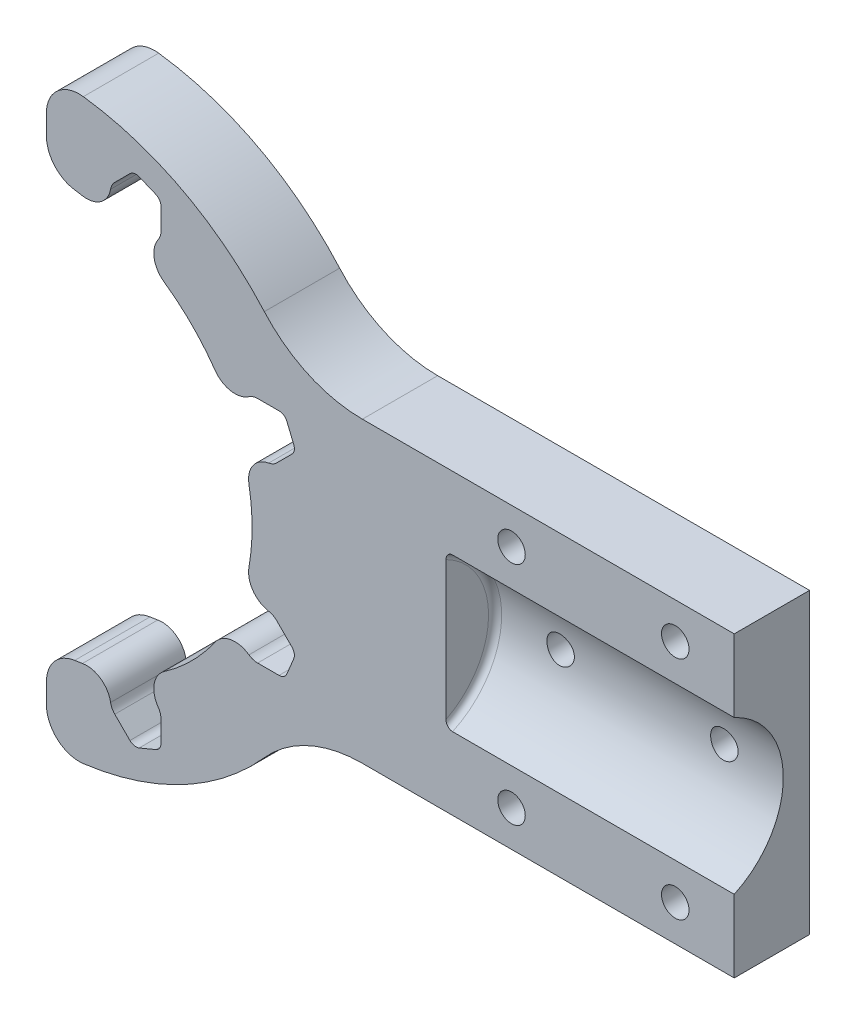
SolidWorks part; units mm, degrees
ref_plane "Front Plane" through (0, 0, 0) normal (1, 0, 0) x (0, 1, 0)
ref_plane "Top Plane" through (0, 0, 0) normal (0, 0, 1) x (0, 1, 0)
ref_plane "Right Plane" through (0, 0, 0) normal (0, 1, 0) x (-1, 0, 0)
sketch "Sketch1" plane through (0, 0, 0) normal (1, 0, 0) x (0, 1, 0)
  line L0 (-11.6833, 0) -> (-22.75, 0)
  line L1 (-22.75, 0) -> (-22.75, -11.5)
  line L2 (-22.75, -11.5) -> (22.75, -11.5)
  line L3 (11.6833, 0) -> (22.75, 0)
  line L4 (22.75, 0) -> (22.75, -11.5)
  arc A0 (-11.6833, 0) -> (11.6833, 0) centre (0, 5.35) ccw
  circle A3 centre (0, 5.35) radius 12.85 construction
  point P7 (0, -11.5)
  dimension "D1" = 12.85
  dimension "D3" = 4
  dimension "D2" = 45.5
  dimension "D4" = 5.35
  dimension "D5" = 11.5
extrude "Boss-Extrude1" add sketch "Sketch1" along normal blind 50
sketch "Sketch3" plane through (0, 0, 0) normal (0, 0, 1) x (1, 0, 0)
  line L0 (0, 22.75) -> (-16.8131, 22.75)
  line L1 (0, 0) -> (-55, 0) construction
  line L2 (0, 11.6833) -> (0, -11.6833) construction
  line L3 (-55, 44.45) -> (-55, -44.45)
  line L4 (0, 22.75) -> (0, -22.75)
  line L5 (0, -22.75) -> (-16.8131, -22.75)
  arc A0 (-55, 44.45) -> (-16.8131, 22.75) centre (-55, 0) cw
  arc A1 (-16.8131, -22.75) -> (-55, -44.45) centre (-55, 0) cw
  point P9 (-55, 0)
  dimension "D2" = 44.45
  dimension "D1" = 55
extrude "Boss-Extrude2" add sketch "Sketch3" against normal blind 11.5
sketch "Sketch4" plane through (0, 0, 0) normal (1, 0, 0) x (0, 1, 0)
  line L2 (11.6833, 0) -> (-11.6833, 0)
  line L3 (11.6833, 0) -> (-11.6833, 0)
  arc A3 (-11.6833, 0) -> (11.6833, 0) centre (0, 5.35) ccw
  arc A4 (-11.6833, 0) -> (11.6833, 0) centre (0, 5.35) ccw
  dimension "D1" = 0
extrude "Boss-Extrude3" add sketch "Sketch4" along normal blind 6
sketch "Sketch5" plane through (0, 0, -11.5) normal (0, 0, -1) x (1, 0, 0)
  line L0 (-55, 0) -> (-17.5829, 15.4987) construction
  line L1 (-55, -44.45) -> (-55, 44.45) construction
  line L2 (-55, 0) -> (0, 0) construction
  line L3 (-18.1049, 16.759) -> (-17.0608, 14.2383)
  line L4 (-19.4907, 17.685) -> (-22.7607, 17.685)
  line L5 (-17.386, 12.6037) -> (-19.6982, 10.2914)
  line L6 (-55, 31.6) -> (-55, -31.6)
  line L7 (-55, 0) -> (-32.6554, 22.3446) construction
  line L8 (-42.3963, 37.614) -> (-44.7086, 35.3018)
  line L9 (-38.241, 36.8951) -> (-40.7617, 37.9392)
  line L10 (-37.315, 35.5093) -> (-37.315, 32.2393)
  line L11 (-17.386, -12.6037) -> (-19.6982, -10.2914)
  line L12 (-18.1049, -16.759) -> (-17.0608, -14.2383)
  line L13 (-19.4907, -17.685) -> (-22.7607, -17.685)
  line L14 (-37.315, -35.5093) -> (-37.315, -32.2393)
  line L15 (-38.241, -36.8951) -> (-40.7617, -37.9392)
  line L16 (-42.3963, -37.614) -> (-44.7086, -35.3018)
  arc A0 (-55, 31.6) -> (-49.4658, 31.1116) centre (-55, 0) cw
  arc A1 (-18.1049, 16.759) -> (-19.4907, 17.685) centre (-19.4907, 16.185) ccw
  arc A2 (-22.7607, 17.685) -> (-24.201, 17.2284) centre (-22.7607, 15.185) ccw
  arc A3 (-29.0875, 18.086) -> (-24.201, 17.2284) centre (-26.2175, 20.0892) ccw
  arc A4 (-17.0608, 14.2383) -> (-17.386, 12.6037) centre (-18.4466, 13.6643) cw
  arc A5 (-19.6982, 10.2914) -> (-21.0395, 9.5958) centre (-21.466, 12.0592) cw
  arc A6 (-23.8884, 5.5342) -> (-21.0395, 9.5958) centre (-20.4425, 6.1471) cw
  arc A7 (-23.8884, 5.5342) -> (-23.8884, -5.5342) centre (-55, 0) cw
  arc A9 (-49.4658, 31.1116) -> (-45.4042, 33.9605) centre (-48.8529, 34.5575) ccw
  arc A10 (-44.7086, 35.3018) -> (-45.4042, 33.9605) centre (-42.9408, 33.534) ccw
  arc A11 (-40.7617, 37.9392) -> (-42.3963, 37.614) centre (-41.3357, 36.5534) ccw
  arc A12 (-38.241, 36.8951) -> (-37.315, 35.5093) centre (-38.815, 35.5093) cw
  arc A13 (-37.315, 32.2393) -> (-37.7716, 30.799) centre (-39.815, 32.2393) cw
  arc A14 (-36.914, 25.9125) -> (-37.7716, 30.799) centre (-34.9108, 28.7825) cw
  arc A15 (-36.914, 25.9125) -> (-29.0875, 18.086) centre (-55, 0) cw
  arc A16 (-23.8884, -5.5342) -> (-21.0395, -9.5958) centre (-20.4425, -6.1471) ccw
  arc A17 (-19.6982, -10.2914) -> (-21.0395, -9.5958) centre (-21.466, -12.0592) ccw
  arc A18 (-17.0608, -14.2383) -> (-17.386, -12.6037) centre (-18.4466, -13.6643) ccw
  arc A19 (-18.1049, -16.759) -> (-19.4907, -17.685) centre (-19.4907, -16.185) cw
  arc A20 (-22.7607, -17.685) -> (-24.201, -17.2284) centre (-22.7607, -15.185) cw
  arc A21 (-29.0875, -18.086) -> (-24.201, -17.2284) centre (-26.2175, -20.0892) cw
  arc A22 (-36.914, -25.9125) -> (-37.7716, -30.799) centre (-34.9108, -28.7825) ccw
  arc A23 (-37.315, -32.2393) -> (-37.7716, -30.799) centre (-39.815, -32.2393) ccw
  arc A24 (-38.241, -36.8951) -> (-37.315, -35.5093) centre (-38.815, -35.5093) ccw
  arc A25 (-40.7617, -37.9392) -> (-42.3963, -37.614) centre (-41.3357, -36.5534) cw
  arc A26 (-44.7086, -35.3018) -> (-45.4042, -33.9605) centre (-42.9408, -33.534) cw
  arc A27 (-49.4658, -31.1116) -> (-45.4042, -33.9605) centre (-48.8529, -34.5575) cw
  arc A28 (-29.0875, -18.086) -> (-36.914, -25.9125) centre (-55, 0) cw
  arc A29 (-49.4658, -31.1116) -> (-55, -31.6) centre (-55, 0) cw
  point P9 (-17.5829, 15.4987)
  dimension "D3" = 31.6
  dimension "D4" = 1.5
  dimension "D6" = 2.5
  dimension "D7" = 3.5
  dimension "D1" = 40.5
  dimension "D2" = 22.5
  dimension "D5" = 3.27
  dimension "D8" = 5.5
  dimension "D9" = 45
extrude "Cut-Extrude1" cut sketch "Sketch5" against normal through all
fillet "Fillet6" radius 20 2 edges at (-16.8131, -22.75, -5.75) (-16.8131, 22.75, -5.75)
fillet "Fillet7" radius 1 1 edges at (6, 0, -7.5)
sketch "Sketch6" plane through (0, 0, 0) normal (0, 0, 1) x (1, 0, 0)
  line L0 (50, 11.6833) -> (7, 11.6833) construction
  line L1 (41, 17.25) -> (16, 17.25) construction
  line L2 (50, 22.75) -> (50, 11.6833) construction
  line L4 (41, 17.25) -> (41, -17.25) construction
  circle A0 centre (41, 17.25) radius 2.1
  circle A1 centre (16, 17.25) radius 2.1
  circle A2 centre (16, -17.25) radius 2.1
  circle A3 centre (41, -17.25) radius 2.1
  point P10 (28.5, 11.6833)
  point P11 (28.5, 17.25)
  point P15 (41, 0)
  dimension "D2" = 4.2
  dimension "D4" = 34.5
  dimension "D1" = 25
  dimension "D3" = 9
extrude "Cut-Extrude2" cut sketch "Sketch6" against normal through all
sketch "Sketch8" plane through (0, 0, 0) normal (0, 0, 1) x (1, 0, 0)
  line L126 (-22.7607, -17.485) -> (-19.4907, -17.485)
  line L127 (-18.2897, -16.6825) -> (-17.2456, -14.1618)
  line L128 (-17.5274, -12.7451) -> (-19.8396, -10.4328)
  line L129 (-19.8396, 10.4328) -> (-17.5274, 12.7451)
  line L130 (-17.2456, 14.1618) -> (-18.2897, 16.6825)
  line L131 (-19.4907, 17.485) -> (-22.7607, 17.485)
  line L132 (-37.515, 32.2393) -> (-37.515, 35.5093)
  line L133 (-38.3175, 36.7103) -> (-40.8382, 37.7544)
  line L134 (-42.2549, 37.4726) -> (-44.5672, 35.1604)
  line L135 (-22.7607, -17.485) -> (-19.4907, -17.485)
  line L136 (-18.2897, -16.6825) -> (-17.2456, -14.1618)
  line L137 (-17.5274, -12.7451) -> (-19.8396, -10.4328)
  line L138 (-19.8396, 10.4328) -> (-17.5274, 12.7451)
  line L139 (-17.2456, 14.1618) -> (-18.2897, 16.6825)
  line L140 (-19.4907, 17.485) -> (-22.7607, 17.485)
  line L141 (-37.515, 32.2393) -> (-37.515, 35.5093)
  line L142 (-38.3175, 36.7103) -> (-40.8382, 37.7544)
  line L143 (-42.2549, 37.4726) -> (-44.5672, 35.1604)
  line L156 (-44.5672, -35.1604) -> (-42.2549, -37.4726)
  line L157 (-40.8382, -37.7544) -> (-38.3175, -36.7103)
  line L158 (-37.515, -35.5093) -> (-37.515, -32.2393)
  line L159 (-44.5672, -35.1604) -> (-42.2549, -37.4726)
  line L160 (-40.8382, -37.7544) -> (-38.3175, -36.7103)
  line L161 (-37.515, -35.5093) -> (-37.515, -32.2393)
  line L201 (-55, -31.4) -> (-55, -31.6)
  line L202 (-55, 31.6) -> (-55, 31.4)
  line L203 (-55, -31.6) -> (-55, -44.45) construction
  line L204 (-55, 44.45) -> (-55, 31.6) construction
  line L222 (-55, -31.6) -> (-55, -44.45)
  line L223 (-6.7689, -22.75) -> (50, -22.75)
  line L224 (50, -22.75) -> (50, -11.6833)
  line L225 (50, -11.6833) -> (7, -11.6833)
  line L226 (6, -10.5736) -> (6, 10.5736)
  line L227 (7, 11.6833) -> (50, 11.6833)
  line L228 (50, 11.6833) -> (50, 22.75)
  line L229 (50, 22.75) -> (-6.7689, 22.75)
  line L230 (-55, 44.45) -> (-55, 31.6)
  line L231 (-44.7086, 35.3018) -> (-42.3963, 37.614)
  line L232 (-40.7617, 37.9392) -> (-38.241, 36.8951)
  line L233 (-37.315, 35.5093) -> (-37.315, 32.2393)
  line L234 (-22.7607, 17.685) -> (-19.4907, 17.685)
  line L235 (-18.1049, 16.759) -> (-17.0608, 14.2383)
  line L236 (-17.386, 12.6037) -> (-19.6982, 10.2914)
  line L237 (-19.6982, -10.2914) -> (-17.386, -12.6037)
  line L238 (-17.0608, -14.2383) -> (-18.1049, -16.759)
  line L239 (-19.4907, -17.685) -> (-22.7607, -17.685)
  line L240 (-37.315, -32.2393) -> (-37.315, -35.5093)
  line L241 (-38.241, -36.8951) -> (-40.7617, -37.9392)
  line L242 (-42.3963, -37.614) -> (-44.7086, -35.3018)
  line L245 (50, -22.75) -> (50, -11.6833)
  line L246 (50, -11.6833) -> (7, -11.6833)
  line L247 (6, -10.5736) -> (6, 10.5736)
  line L248 (7, 11.6833) -> (50, 11.6833)
  line L249 (50, 11.6833) -> (50, 22.75)
  line L252 (-44.7086, 35.3018) -> (-42.3963, 37.614)
  line L253 (-40.7617, 37.9392) -> (-38.241, 36.8951)
  line L254 (-37.315, 35.5093) -> (-37.315, 32.2393)
  line L255 (-22.7607, 17.685) -> (-19.4907, 17.685)
  line L256 (-18.1049, 16.759) -> (-17.0608, 14.2383)
  line L257 (-17.386, 12.6037) -> (-19.6982, 10.2914)
  line L258 (-19.6982, -10.2914) -> (-17.386, -12.6037)
  line L259 (-17.0608, -14.2383) -> (-18.1049, -16.759)
  line L260 (-19.4907, -17.685) -> (-22.7607, -17.685)
  line L261 (-37.315, -32.2393) -> (-37.315, -35.5093)
  line L262 (-38.241, -36.8951) -> (-40.7617, -37.9392)
  line L263 (-42.3963, -37.614) -> (-44.7086, -35.3018)
  arc A308 (-19.4907, -17.485) -> (-18.2897, -16.6825) centre (-19.4907, -16.185) ccw
  arc A309 (-17.2456, -14.1618) -> (-17.5274, -12.7451) centre (-18.4466, -13.6643) ccw
  arc A310 (-19.8396, -10.4328) -> (-21.0736, -9.7929) centre (-21.466, -12.0592) ccw
  arc A311 (-24.0853, -5.4991) -> (-21.0736, -9.7929) centre (-20.4425, -6.1471) ccw
  arc A312 (-24.0853, -5.4991) -> (-24.0853, 5.4991) centre (-55, 0) ccw
  arc A313 (-21.0736, 9.7929) -> (-24.0853, 5.4991) centre (-20.4425, 6.1471) ccw
  arc A314 (-21.0736, 9.7929) -> (-19.8396, 10.4328) centre (-21.466, 12.0592) ccw
  arc A315 (-17.5274, 12.7451) -> (-17.2456, 14.1618) centre (-18.4466, 13.6643) ccw
  arc A316 (-18.2897, 16.6825) -> (-19.4907, 17.485) centre (-19.4907, 16.185) ccw
  arc A317 (-22.7607, 17.485) -> (-24.0858, 17.0649) centre (-22.7607, 15.185) ccw
  arc A318 (-29.2515, 17.9715) -> (-24.0858, 17.0649) centre (-26.2175, 20.0892) ccw
  arc A319 (-29.2515, 17.9715) -> (-37.0285, 25.7485) centre (-55, 0) ccw
  arc A320 (-37.9351, 30.9142) -> (-37.0285, 25.7485) centre (-34.9108, 28.7825) ccw
  arc A321 (-37.9351, 30.9142) -> (-37.515, 32.2393) centre (-39.815, 32.2393) ccw
  arc A322 (-37.515, 35.5093) -> (-38.3175, 36.7103) centre (-38.815, 35.5093) ccw
  arc A323 (-40.8382, 37.7544) -> (-42.2549, 37.4726) centre (-41.3357, 36.5534) ccw
  arc A324 (-44.5672, 35.1604) -> (-45.2071, 33.9264) centre (-42.9408, 33.534) ccw
  arc A325 (-49.5009, 30.9147) -> (-45.2071, 33.9264) centre (-48.8529, 34.5575) ccw
  arc A326 (-49.5009, 30.9147) -> (-55, 31.4) centre (-55, 0) ccw
  arc A327 (-19.4907, -17.485) -> (-18.2897, -16.6825) centre (-19.4907, -16.185) ccw
  arc A328 (-17.2456, -14.1618) -> (-17.5274, -12.7451) centre (-18.4466, -13.6643) ccw
  arc A329 (-19.8396, -10.4328) -> (-21.0736, -9.7929) centre (-21.466, -12.0592) ccw
  arc A330 (-24.0853, -5.4991) -> (-21.0736, -9.7929) centre (-20.4425, -6.1471) ccw
  arc A331 (-24.0853, -5.4991) -> (-24.0853, 5.4991) centre (-55, 0) ccw
  arc A332 (-21.0736, 9.7929) -> (-24.0853, 5.4991) centre (-20.4425, 6.1471) ccw
  arc A333 (-21.0736, 9.7929) -> (-19.8396, 10.4328) centre (-21.466, 12.0592) ccw
  arc A334 (-17.5274, 12.7451) -> (-17.2456, 14.1618) centre (-18.4466, 13.6643) ccw
  arc A335 (-18.2897, 16.6825) -> (-19.4907, 17.485) centre (-19.4907, 16.185) ccw
  arc A336 (-22.7607, 17.485) -> (-24.0858, 17.0649) centre (-22.7607, 15.185) ccw
  arc A337 (-29.2515, 17.9715) -> (-24.0858, 17.0649) centre (-26.2175, 20.0892) ccw
  arc A338 (-29.2515, 17.9715) -> (-37.0285, 25.7485) centre (-55, 0) ccw
  arc A339 (-37.9351, 30.9142) -> (-37.0285, 25.7485) centre (-34.9108, 28.7825) ccw
  arc A340 (-37.9351, 30.9142) -> (-37.515, 32.2393) centre (-39.815, 32.2393) ccw
  arc A341 (-37.515, 35.5093) -> (-38.3175, 36.7103) centre (-38.815, 35.5093) ccw
  arc A342 (-40.8382, 37.7544) -> (-42.2549, 37.4726) centre (-41.3357, 36.5534) ccw
  arc A343 (-44.5672, 35.1604) -> (-45.2071, 33.9264) centre (-42.9408, 33.534) ccw
  arc A344 (-49.5009, 30.9147) -> (-45.2071, 33.9264) centre (-48.8529, 34.5575) ccw
  arc A345 (-49.5009, 30.9147) -> (-55, 31.4) centre (-55, 0) ccw
  arc A402 (-55, -31.6) -> (-49.4658, -31.1116) centre (-55, 0) ccw
  arc A403 (-55, -31.6) -> (-49.4658, -31.1116) centre (-55, 0) ccw
  arc A410 (-55, -31.4) -> (-49.5009, -30.9147) centre (-55, 0) ccw
  arc A411 (-45.2071, -33.9264) -> (-49.5009, -30.9147) centre (-48.8529, -34.5575) ccw
  arc A412 (-45.2071, -33.9264) -> (-44.5672, -35.1604) centre (-42.9408, -33.534) ccw
  arc A413 (-42.2549, -37.4726) -> (-40.8382, -37.7544) centre (-41.3357, -36.5534) ccw
  arc A414 (-38.3175, -36.7103) -> (-37.515, -35.5093) centre (-38.815, -35.5093) ccw
  arc A415 (-37.515, -32.2393) -> (-37.9351, -30.9142) centre (-39.815, -32.2393) ccw
  arc A416 (-37.0285, -25.7485) -> (-37.9351, -30.9142) centre (-34.9108, -28.7825) ccw
  arc A417 (-37.0285, -25.7485) -> (-29.2515, -17.9715) centre (-55, 0) ccw
  arc A418 (-24.0858, -17.0649) -> (-29.2515, -17.9715) centre (-26.2175, -20.0892) ccw
  arc A419 (-24.0858, -17.0649) -> (-22.7607, -17.485) centre (-22.7607, -15.185) ccw
  arc A420 (-55, -31.4) -> (-49.5009, -30.9147) centre (-55, 0) ccw
  arc A421 (-45.2071, -33.9264) -> (-49.5009, -30.9147) centre (-48.8529, -34.5575) ccw
  arc A422 (-45.2071, -33.9264) -> (-44.5672, -35.1604) centre (-42.9408, -33.534) ccw
  arc A423 (-42.2549, -37.4726) -> (-40.8382, -37.7544) centre (-41.3357, -36.5534) ccw
  arc A424 (-38.3175, -36.7103) -> (-37.515, -35.5093) centre (-38.815, -35.5093) ccw
  arc A425 (-37.515, -32.2393) -> (-37.9351, -30.9142) centre (-39.815, -32.2393) ccw
  arc A426 (-37.0285, -25.7485) -> (-37.9351, -30.9142) centre (-34.9108, -28.7825) ccw
  arc A427 (-37.0285, -25.7485) -> (-29.2515, -17.9715) centre (-55, 0) ccw
  arc A428 (-24.0858, -17.0649) -> (-29.2515, -17.9715) centre (-26.2175, -20.0892) ccw
  arc A429 (-24.0858, -17.0649) -> (-22.7607, -17.485) centre (-22.7607, -15.185) ccw
  arc A522 (-45.4042, -33.9605) -> (-49.4658, -31.1116) centre (-48.8529, -34.5575) ccw
  arc A523 (-55, -31.6) -> (-49.4658, -31.1116) centre (-55, 0) ccw
  arc A524 (-55, -44.45) -> (-21.7359, -29.4839) centre (-55, 0) ccw
  arc A525 (-6.7689, -22.75) -> (-21.7359, -29.4839) centre (-6.7689, -42.75) ccw
  arc A526 (-21.7359, 29.4839) -> (-6.7689, 22.75) centre (-6.7689, 42.75) ccw
  arc A527 (-21.7359, 29.4839) -> (-55, 44.45) centre (-55, 0) ccw
  arc A528 (-49.4658, 31.1116) -> (-55, 31.6) centre (-55, 0) ccw
  arc A529 (-49.4658, 31.1116) -> (-45.4042, 33.9605) centre (-48.8529, 34.5575) ccw
  arc A530 (-44.7086, 35.3018) -> (-45.4042, 33.9605) centre (-42.9408, 33.534) ccw
  arc A531 (-40.7617, 37.9392) -> (-42.3963, 37.614) centre (-41.3357, 36.5534) ccw
  arc A532 (-37.315, 35.5093) -> (-38.241, 36.8951) centre (-38.815, 35.5093) ccw
  arc A533 (-37.7716, 30.799) -> (-37.315, 32.2393) centre (-39.815, 32.2393) ccw
  arc A534 (-37.7716, 30.799) -> (-36.914, 25.9125) centre (-34.9108, 28.7825) ccw
  arc A535 (-29.0875, 18.086) -> (-36.914, 25.9125) centre (-55, 0) ccw
  arc A536 (-29.0875, 18.086) -> (-24.201, 17.2284) centre (-26.2175, 20.0892) ccw
  arc A537 (-22.7607, 17.685) -> (-24.201, 17.2284) centre (-22.7607, 15.185) ccw
  arc A538 (-18.1049, 16.759) -> (-19.4907, 17.685) centre (-19.4907, 16.185) ccw
  arc A539 (-17.386, 12.6037) -> (-17.0608, 14.2383) centre (-18.4466, 13.6643) ccw
  arc A540 (-21.0395, 9.5958) -> (-19.6982, 10.2914) centre (-21.466, 12.0592) ccw
  arc A541 (-21.0395, 9.5958) -> (-23.8884, 5.5342) centre (-20.4425, 6.1471) ccw
  arc A542 (-23.8884, -5.5342) -> (-23.8884, 5.5342) centre (-55, 0) ccw
  arc A543 (-23.8884, -5.5342) -> (-21.0395, -9.5958) centre (-20.4425, -6.1471) ccw
  arc A544 (-19.6982, -10.2914) -> (-21.0395, -9.5958) centre (-21.466, -12.0592) ccw
  arc A545 (-17.0608, -14.2383) -> (-17.386, -12.6037) centre (-18.4466, -13.6643) ccw
  arc A546 (-19.4907, -17.685) -> (-18.1049, -16.759) centre (-19.4907, -16.185) ccw
  arc A547 (-24.201, -17.2284) -> (-22.7607, -17.685) centre (-22.7607, -15.185) ccw
  arc A548 (-24.201, -17.2284) -> (-29.0875, -18.086) centre (-26.2175, -20.0892) ccw
  arc A549 (-36.914, -25.9125) -> (-29.0875, -18.086) centre (-55, 0) ccw
  arc A550 (-36.914, -25.9125) -> (-37.7716, -30.799) centre (-34.9108, -28.7825) ccw
  arc A551 (-37.315, -32.2393) -> (-37.7716, -30.799) centre (-39.815, -32.2393) ccw
  arc A552 (-38.241, -36.8951) -> (-37.315, -35.5093) centre (-38.815, -35.5093) ccw
  arc A553 (-42.3963, -37.614) -> (-40.7617, -37.9392) centre (-41.3357, -36.5534) ccw
  arc A554 (-45.4042, -33.9605) -> (-44.7086, -35.3018) centre (-42.9408, -33.534) ccw
  arc A555 (-45.4042, -33.9605) -> (-49.4658, -31.1116) centre (-48.8529, -34.5575) ccw
  arc A556 (-55, -31.6) -> (-49.4658, -31.1116) centre (-55, 0) ccw
  arc A561 (-49.4658, 31.1116) -> (-55, 31.6) centre (-55, 0) ccw
  arc A562 (-49.4658, 31.1116) -> (-45.4042, 33.9605) centre (-48.8529, 34.5575) ccw
  arc A563 (-44.7086, 35.3018) -> (-45.4042, 33.9605) centre (-42.9408, 33.534) ccw
  arc A564 (-40.7617, 37.9392) -> (-42.3963, 37.614) centre (-41.3357, 36.5534) ccw
  arc A565 (-37.315, 35.5093) -> (-38.241, 36.8951) centre (-38.815, 35.5093) ccw
  arc A566 (-37.7716, 30.799) -> (-37.315, 32.2393) centre (-39.815, 32.2393) ccw
  arc A567 (-37.7716, 30.799) -> (-36.914, 25.9125) centre (-34.9108, 28.7825) ccw
  arc A568 (-29.0875, 18.086) -> (-36.914, 25.9125) centre (-55, 0) ccw
  arc A569 (-29.0875, 18.086) -> (-24.201, 17.2284) centre (-26.2175, 20.0892) ccw
  arc A570 (-22.7607, 17.685) -> (-24.201, 17.2284) centre (-22.7607, 15.185) ccw
  arc A571 (-18.1049, 16.759) -> (-19.4907, 17.685) centre (-19.4907, 16.185) ccw
  arc A572 (-17.386, 12.6037) -> (-17.0608, 14.2383) centre (-18.4466, 13.6643) ccw
  arc A573 (-21.0395, 9.5958) -> (-19.6982, 10.2914) centre (-21.466, 12.0592) ccw
  arc A574 (-21.0395, 9.5958) -> (-23.8884, 5.5342) centre (-20.4425, 6.1471) ccw
  arc A575 (-23.8884, -5.5342) -> (-23.8884, 5.5342) centre (-55, 0) ccw
  arc A576 (-23.8884, -5.5342) -> (-21.0395, -9.5958) centre (-20.4425, -6.1471) ccw
  arc A577 (-19.6982, -10.2914) -> (-21.0395, -9.5958) centre (-21.466, -12.0592) ccw
  arc A578 (-17.0608, -14.2383) -> (-17.386, -12.6037) centre (-18.4466, -13.6643) ccw
  arc A579 (-19.4907, -17.685) -> (-18.1049, -16.759) centre (-19.4907, -16.185) ccw
  arc A580 (-24.201, -17.2284) -> (-22.7607, -17.685) centre (-22.7607, -15.185) ccw
  arc A581 (-24.201, -17.2284) -> (-29.0875, -18.086) centre (-26.2175, -20.0892) ccw
  arc A582 (-36.914, -25.9125) -> (-29.0875, -18.086) centre (-55, 0) ccw
  arc A583 (-36.914, -25.9125) -> (-37.7716, -30.799) centre (-34.9108, -28.7825) ccw
  arc A584 (-37.315, -32.2393) -> (-37.7716, -30.799) centre (-39.815, -32.2393) ccw
  arc A585 (-38.241, -36.8951) -> (-37.315, -35.5093) centre (-38.815, -35.5093) ccw
  arc A586 (-42.3963, -37.614) -> (-40.7617, -37.9392) centre (-41.3357, -36.5534) ccw
  arc A587 (-45.4042, -33.9605) -> (-44.7086, -35.3018) centre (-42.9408, -33.534) ccw
  spline S6 degree 3 poles (-2509.1902, 1617.4644) (74.8781, 92.452) (14.5263, -15.4123) (6.4748, -11.5311) (6.3635, -11.4434) (6.1842, -11.234) (6.1149, -11.1114) (2.2458, -0.1287) (157.5697, 59.7873) (438.961, -2975.224) knots -15.702008 -15.702008 -15.702008 -15.702008 0.25 0.25 0.5 0.5 0.75 0.75 21.537794 21.537794 21.537794 21.537794 only from (7, -11.6833) to (6, -10.5736)
  spline S7 degree 3 poles (-2216.2851, 2016.2911) (470.859, -114.1931) (-0.4913, -7.6679) (6.115, 11.1119) (6.1825, 11.2319) (6.3638, 11.444) (6.4731, 11.5301) (15.0642, 15.682) (77.3735, -109.086) (-2475.6451, -1666.9153) knots -35.198245 -35.198245 -35.198245 -35.198245 0.25 0.25 0.5 0.5 0.75 0.75 17.674717 17.674717 17.674717 17.674717 only from (6, 10.5736) to (7, 11.6833)
  spline S8 degree 3 poles (7, -11.6833) (6.8604, -11.6833) (6.7233, -11.6509) (6.4748, -11.5311) (6.3635, -11.4434) (6.1842, -11.234) (6.1149, -11.1114) (6.023, -10.8504) (6, -10.7128) (6, -10.5736) knots 0 0 0 0 0.25 0.25 0.5 0.5 0.75 0.75 1 1 1 1
  spline S9 degree 3 poles (6, 10.5736) (6, 10.713) (6.0225, 10.8489) (6.115, 11.1119) (6.1825, 11.2319) (6.3638, 11.444) (6.4731, 11.5301) (6.7232, 11.651) (6.8601, 11.6833) (7, 11.6833) knots 0 0 0 0 0.25 0.25 0.5 0.5 0.75 0.75 1 1 1 1
  dimension "D1" = 0.2
  dimension "D2" = 0.2
  dimension "D3" = 0
  dimension "D4" = 0
extrude "Boss-Extrude4" add sketch "Sketch8" against normal up to surface (11.5 mm away) contours A555 A587 L263 A586 L262 A585 L261 A584 A583 A582 A581 A580 L260 A579 L259 A578 L258 A577 A576 A575 A574 A573 L257 A572 L256 A571 L255 A570 A569 A568 A567 A566 L254 A565 L253 A564 L252 A563 A562 A561 L202 A345 A344 A343 L143 A342 L142 A341 L141 A340 A339
fillet "Fillet11" radius 5 4 edges at (-55, 31.4, -5.75) (-55, 44.45, -5.75) (-55, -31.4, -5.75) (-55, -44.45, -5.75)
sketch "Sketch9" plane through (0, 0, -11.5) normal (0, 0, -1) x (1, 0, 0)
  line L0 (16, 17.25) -> (16, -17.25) construction
  line L1 (41, 17.25) -> (41, -17.25) construction
  circle A0 centre (16, 0) radius 2.1
  circle A1 centre (41, 0) radius 2.1
  dimension "D1" = 4.2
extrude "Cut-Extrude3" cut sketch "Sketch9" against normal through all and the other way through all
